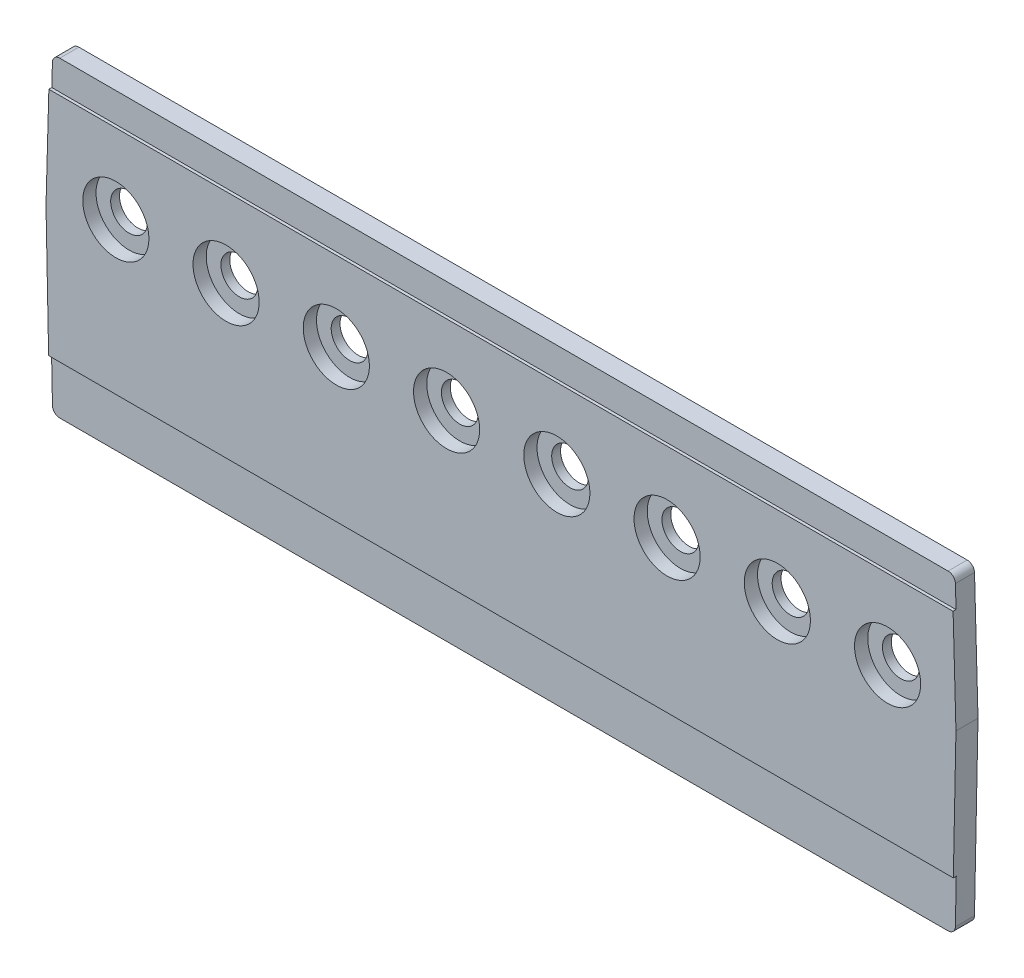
SolidWorks part; units mm, degrees
ref_plane "Plan de face" through (0, 0, 0) normal (0, 0, 1) x (1, 0, 0)
ref_plane "Plan de dessus" through (0, 0, 0) normal (0, 1, 0) x (1, 0, 0)
ref_plane "Plan de droite" through (0, 0, 0) normal (1, 0, 0) x (0, 0, -1)
sketch "Esquisse1" plane through (0, 0, 0) normal (0, 0, 1) x (1, 0, 0)
  line L0 (0, -14.2402) -> (0, 52.3672) construction
  line L1 (-7.052, 0) -> (132.3643, 0) construction
  line L2 (121.7066, 27.6) -> (-7.052, 27.6) construction
  line L3 (1.4798, 0) -> (122.3202, 0)
  line L4 (0, 24.5) -> (0.4728, 41.4279)
  line L5 (1.4725, 42.4) -> (122.3275, 42.4)
  line L6 (123.8, 24.5) -> (123.32, 0.9796)
  line L7 (9.4, 52.3672) -> (9.4, 19.2584) construction
  line L8 (128.721, 24.5) -> (78.8644, 24.5) construction
  line L9 (123.8, -14.2402) -> (123.8, 52.3672) construction
  line L10 (132.3643, 42.4) -> (-7.052, 42.4) construction
  line L11 (61.9, -5.4391) -> (61.9, 16.1854) construction
  line L12 (123.3, -4.7818) -> (123.3, 44.608) construction
  line L13 (123.8, 24.5) -> (123.3272, 41.4279)
  line L14 (0, 24.5) -> (0.48, 0.9796)
  circle A0 centre (9.5, 27.6) radius 2.5
  circle A1 centre (24.5, 27.6) radius 2.5
  circle A2 centre (39.5, 27.6) radius 2.5
  circle A3 centre (54.5, 27.6) radius 2.5
  circle A4 centre (69.5, 27.6) radius 2.5
  circle A5 centre (84.5, 27.6) radius 2.5
  circle A6 centre (99.5, 27.6) radius 2.5
  circle A7 centre (114.5, 27.6) radius 2.5
  arc A8 (123.32, 0.9796) -> (122.3202, 0) centre (122.3202, 1) cw
  arc A9 (123.3272, 41.4279) -> (122.3275, 42.4) centre (122.3275, 41.4) ccw
  arc A10 (0.4728, 41.4279) -> (1.4725, 42.4) centre (1.4725, 41.4) cw
  arc A11 (0.48, 0.9796) -> (1.4798, 0) centre (1.4798, 1) ccw
  point P44 (123.3, 42.4)
  point P52 (0.5, 42.4)
  dimension "D4" = 8
  dimension "D6" = 24.5
  dimension "D9" = 1
  dimension "D1" = 9.4
  dimension "D2" = 123.8
  dimension "D3" = 27.6
  dimension "D5" = 42.4
  dimension "D7" = 0.5
  dimension "D8" = 61.9
extrude "Boss.-Extru.1" add sketch "Esquisse1" along normal blind 3
sketch "Esquisse2" plane through (0, 0, 3) normal (0, 0, 1) x (1, 0, 0)
  circle A0 centre (9.5, 27.6) radius 4.5
  circle A2 centre (24.5, 27.6) radius 4.5
  circle A3 centre (39.5, 27.6) radius 4.5
  circle A4 centre (54.5, 27.6) radius 4.5
  circle A5 centre (69.5, 27.6) radius 4.5
  circle A6 centre (84.5, 27.6) radius 4.5
  circle A7 centre (99.5, 27.6) radius 4.5
  circle A8 centre (114.5, 27.6) radius 4.5
extrude "Enlèv. mat.-Extru.1" cut sketch "Esquisse2" against normal blind 1.8
sketch "Esquisse3" plane through (0, 0, 3) normal (0, 0, 1) x (1, 0, 0)
  line L0 (131.0005, 0) -> (-5.8272, 0) construction
  line L1 (131.0005, 7) -> (-5.8272, 7) construction
  line L2 (131.0005, 42.4) -> (-5.8272, 42.4) construction
  line L3 (131.0005, 38.4) -> (-5.8272, 38.4) construction
  line L5 (0, 42.4) -> (124.3754, 42.4)
  line L6 (0, 42.4) -> (0, 38.4)
  line L7 (0, 38.4) -> (124.3754, 38.4)
  line L8 (124.3754, 42.4) -> (124.3754, 38.4)
  line L9 (-0.9598, 7) -> (124.3754, 7)
  line L10 (-0.9598, 7) -> (-0.9598, 0)
  line L11 (-0.9598, 0) -> (124.3754, 0)
  line L12 (124.3754, 7) -> (124.3754, 0)
  dimension "D1" = 4
  dimension "D2" = 7
extrude "Enlèv. mat.-Extru.2" cut sketch "Esquisse3" against normal blind 0.4
